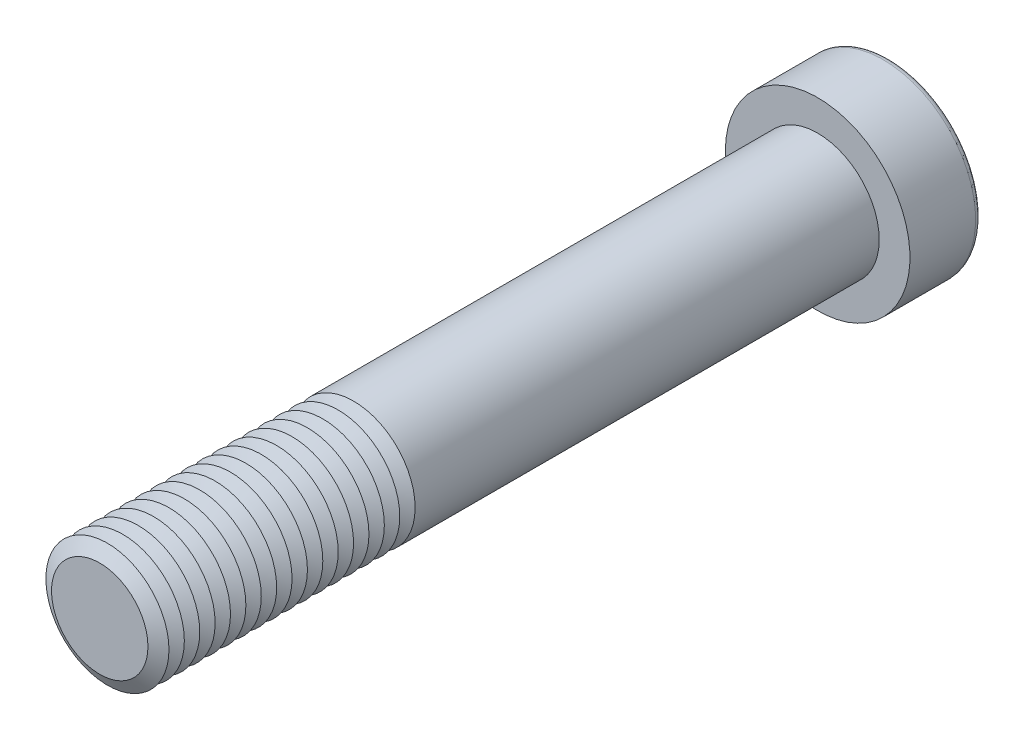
SolidWorks part; units mm, degrees
ref_plane "Front Plane" through (0, 0, 0) normal (0, 0, 1) x (1, 0, 0)
ref_plane "Top Plane" through (0, 0, 0) normal (0, 1, 0) x (1, 0, 0)
ref_plane "Right Plane" through (0, 0, 0) normal (1, 0, 0) x (0, 0, -1)
sketch "Sketch1" plane through (0, 0, 0) normal (0, 0, 1) x (1, 0, 0)
  circle A0 centre (0, 0) radius 12
  dimension "D1" = 24
extrude "Boss-Extrude1" add sketch "Sketch1" along normal blind 140
sketch "Sketch2" plane through (0, 0, 0) normal (0, 0, -1) x (-1, 0, 0)
  circle A0 centre (0, 0) radius 18
  dimension "D1" = 36
extrude "Boss-Extrude2" add sketch "Sketch2" along normal blind 14
sketch "Sketch3" plane through (0, 0, -14) normal (0, 0, -1) x (-1, 0, 0)
  line L1 (-5.4848, 9.5) -> (-10.9697, 0)
  line L2 (-10.9697, 0) -> (-5.4848, -9.5)
  line L3 (-5.4848, -9.5) -> (5.4848, -9.5)
  line L4 (5.4848, -9.5) -> (10.9697, 0)
  line L5 (10.9697, 0) -> (5.4848, 9.5)
  line L6 (5.4848, 9.5) -> (-5.4848, 9.5)
  circle A0 centre (0, 0) radius 9.5 construction
  dimension "D1" = 19
extrude "Cut-Extrude1" cut sketch "Sketch3" against normal blind 14.25
fillet "Fillet1" radius 1.2 1 edges at (-18, 0, -14)
sketch "Sketch4" plane through (0, 0, 0.25) normal (0, 0, -1) x (-1, 0, 0)
  line L0 (5.4848, -9.5) -> (10.9697, 0) construction
  circle A0 centre (0, 0) radius 9.5
extrude "Cut-Extrude2" cut sketch "Sketch4" against normal through all draft 60
sketch "Sketch5" plane through (0, 0, -14) normal (0, 0, -1) x (-1, 0, 0)
  circle A0 centre (0, 0) radius 10.9697
extrude "Cut-Extrude3" cut sketch "Sketch5" against normal through all draft 75
sketch "Sketch7" plane through (0, 0, 0) normal (1, 0, 0) x (0, 0, -1)
  line L25 (-140, 9.4019) -> (-138.5, 12)
  line L26 (-140, 12) -> (-140, -12) construction
  line L27 (-138.5, 12) -> (-141.5, 12)
  line L28 (-141.5, 12) -> (-140, 9.4019)
  line L29 (0, 12) -> (-140, 12) construction
  dimension "D1" = 3
revolve "Cut-Revolve1" cut sketch "Sketch7" angle 360 about axis through (0, 0, 140) along (0, 0, -1)
pattern_linear "LPattern1" count 17 spacing 3 along (0, 0, -1) of "Cut-Revolve1"
